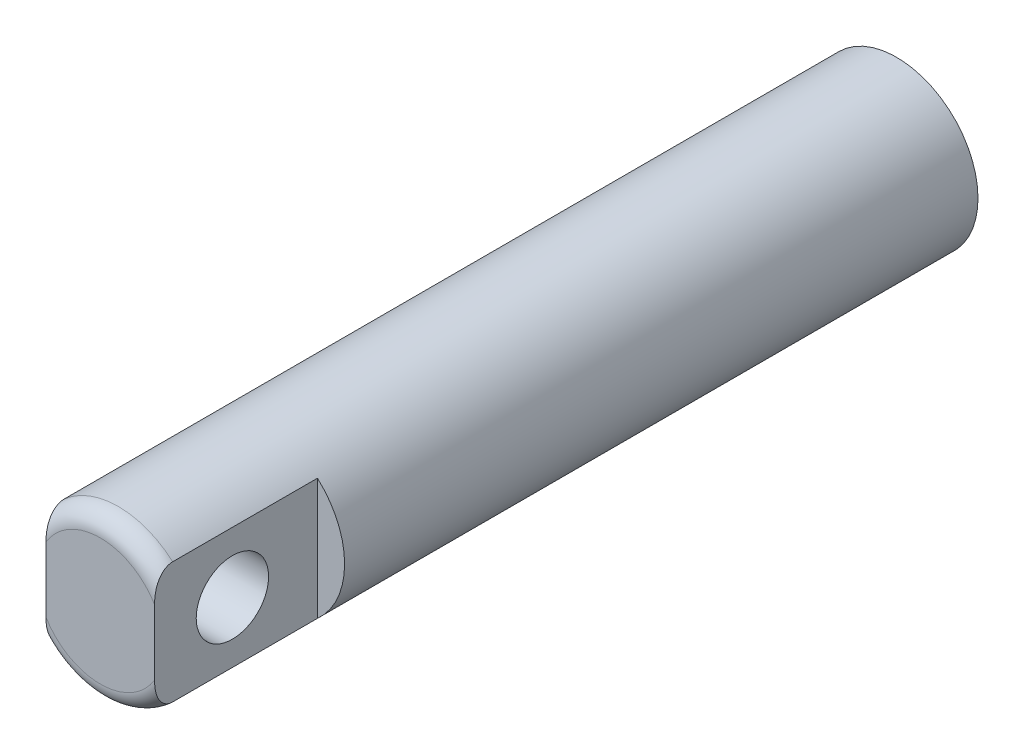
SolidWorks part; units mm, degrees
ref_plane "Спереди" through (0, 0, 0) normal (0, 0, 1) x (1, 0, 0)
ref_plane "Сверху" through (0, 0, 0) normal (0, 1, 0) x (1, 0, 0)
ref_plane "Справа" through (0, 0, 0) normal (1, 0, 0) x (0, 0, -1)
sketch "Эскиз1" plane through (0, 0, 0) normal (0, 0, 1) x (1, 0, 0)
  circle A0 centre (0, 0) radius 4.5
  dimension "D1" = 9
extrude "Бобышка-Вытянуть1" add sketch "Эскиз1" along normal blind 35
sketch "Эскиз2" plane through (0, 0, 35) normal (0, 0, 1) x (1, 0, 0)
  line L1 (3, -3.3541) -> (-3, -3.3541)
  line L2 (3, -3.3541) -> (3, 3.3541)
  line L3 (3, 3.3541) -> (-3, 3.3541)
  line L4 (-3, -3.3541) -> (-3, 3.3541)
  line L5 (3, -3.3541) -> (-3, 3.3541) construction
  line L6 (3, 3.3541) -> (-3, -3.3541) construction
  arc A0 (3, 3.3541) -> (-3, 3.3541) centre (0, 0) ccw
  circle A1 centre (0, 0) radius 4.5
  arc A2 (-3, -3.3541) -> (3, -3.3541) centre (0, 0) ccw
  dimension "D2" = 6
  dimension "D1" = 0
extrude "Бобышка-Вытянуть2" add sketch "Эскиз2" along normal blind 9 contours L3 M3 | L4 L1 L2 L3 | L1 M3
sketch "Эскиз3" plane through (-3, 0, 0) normal (-1, 0, 0) x (0, 0, 1)
  line L0 (44, -3.3541) -> (44, 3.3541) construction
  circle A0 centre (39.7, 0) radius 2
  dimension "D1" = 4
  dimension "D2" = 4.3
extrude "Вырез-Вытянуть1" cut sketch "Эскиз3" against normal through all
fillet "Скругление1" radius 1 2 edges at (0, 4.5, 44) (0, -4.5, 44)
